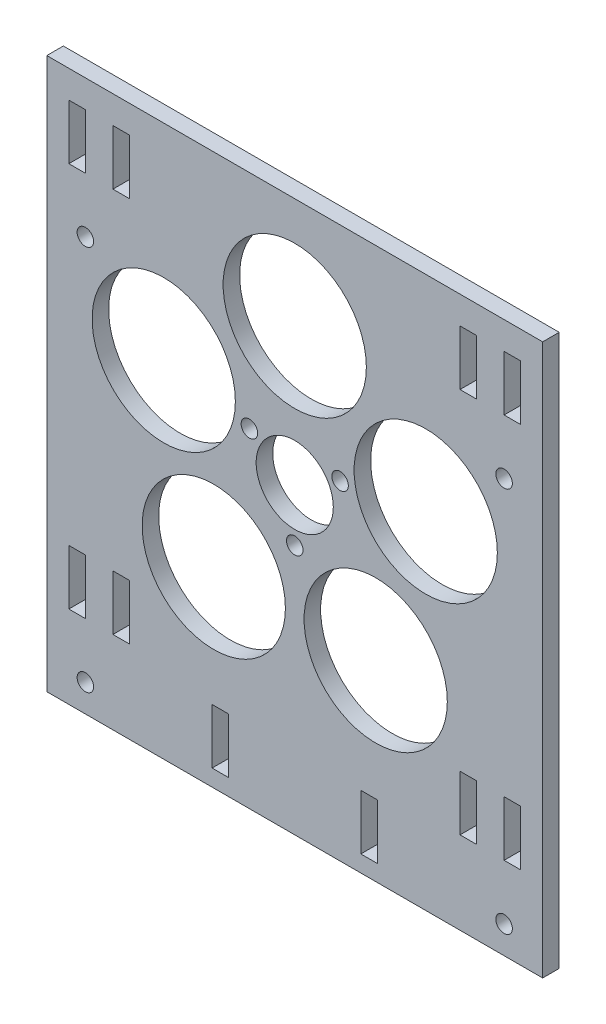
SolidWorks part; units mm, degrees
ref_plane "前视基准面" through (0, 0, 0) normal (0, 0, 1) x (1, 0, 0)
ref_plane "上视基准面" through (0, 0, 0) normal (0, 1, 0) x (1, 0, 0)
ref_plane "右视基准面" through (0, 0, 0) normal (1, 0, 0) x (0, 0, -1)
sketch "草图1" plane through (0, 0, 0) normal (0, 0, 1) x (1, 0, 0)
  line L0 (0, 0) -> (-23.7764, 7.7254) construction
  circle A0 centre (0, 0) radius 12.5
  circle A1 centre (0, 25) radius 12.5
  circle A2 centre (23.7764, 7.7254) radius 12.5
  circle A3 centre (14.6946, -20.2254) radius 12.5
  circle A4 centre (-14.6946, -20.2254) radius 12.5
  circle A5 centre (-23.7764, 7.7254) radius 12.5
  circle A6 centre (-23.7764, 7.7254) radius 10.5
  circle A7 centre (0, 25) radius 10.5
  circle A8 centre (23.7764, 7.7254) radius 10.5
  circle A9 centre (-14.6946, -20.2254) radius 10.5
  circle A10 centre (14.6946, -20.2254) radius 10.5
  circle A11 centre (-23.7764, 7.7254) radius 9
  circle A12 centre (0, 25) radius 9
  circle A13 centre (23.7764, 7.7254) radius 9
  circle A14 centre (14.6946, -20.2254) radius 9
  circle A15 centre (-14.6946, -20.2254) radius 9
  circle A17 centre (0, 0) radius 35.5
  point P16 (0, 0)
  dimension "D1" = 25
  dimension "D2" = 25
  dimension "D4" = 21
  dimension "D5" = 21
  dimension "D6" = 21
  dimension "D7" = 21
  dimension "D8" = 18
  dimension "D11" = 21
  dimension "D3" = 5
  dimension "D10" = 25
  dimension "D9" = 5
sketch "草图2" plane through (0, 0, 0) normal (0, 0, 1) x (1, 0, 0)
  line L0 (-10.5, 25) -> (-10.5, 27.9643)
  line L1 (10.5, 25) -> (10.5, 27.9643)
  line L2 (20.5317, 17.7115) -> (23.3509, 18.6275)
  line L3 (27.0211, -2.2607) -> (29.8403, -1.3447)
  line L4 (23.1893, -14.0537) -> (24.9317, -16.4518)
  line L5 (6.2, -26.3972) -> (7.9423, -28.7953)
  line L6 (-6.2, -26.3972) -> (-7.9423, -28.7953)
  line L7 (-23.1893, -14.0537) -> (-24.9317, -16.4518)
  line L8 (-27.0211, -2.2607) -> (-29.8403, -1.3447)
  line L9 (-20.5317, 17.7115) -> (-23.3509, 18.6275)
  line L11 (0, 0) -> (27.0211, -2.2607) construction
  circle A0 centre (14.6946, -20.2254) radius 10.5 construction
  circle A1 centre (-14.6946, -20.2254) radius 10.5 construction
  circle A2 centre (23.7764, 7.7254) radius 10.5 construction
  circle A3 centre (0, 25) radius 10.5 construction
  circle A4 centre (-23.7764, 7.7254) radius 10.5 construction
  circle A5 centre (0, 0) radius 35.5 construction
  arc A6 (23.1893, -14.0537) -> (6.2, -26.3972) centre (14.6946, -20.2254) ccw
  arc A7 (-6.2, -26.3972) -> (-23.1893, -14.0537) centre (-14.6946, -20.2254) ccw
  arc A8 (20.5317, 17.7115) -> (27.0211, -2.2607) centre (23.7764, 7.7254) ccw
  arc A9 (-10.5, 25) -> (10.5, 25) centre (0, 25) ccw
  arc A10 (-27.0211, -2.2607) -> (-20.5317, 17.7115) centre (-23.7764, 7.7254) ccw
  arc A11 (-16.3413, 31.5153) -> (-24.9231, 25.2802) centre (0, 0) ccw
  arc A12 (-35.0225, -5.8027) -> (-31.7446, -15.8912) centre (0, 0) ccw
  arc A13 (24.9231, 25.2802) -> (16.3413, 31.5153) centre (0, 0) ccw
  arc A14 (31.7446, -15.8912) -> (35.0225, -5.8027) centre (0, 0) ccw
  arc A15 (-5.3039, -35.1016) -> (5.3039, -35.1016) centre (0, 0) ccw
  arc A16 (23.3509, 18.6275) -> (24.9231, 25.2802) centre (22.1148, 22.4318) ccw
  arc A17 (10.5, 27.9643) -> (16.3413, 31.5153) centre (14.5, 27.9643) cw
  arc A18 (-10.5, 27.9643) -> (-16.3413, 31.5153) centre (-14.5, 27.9643) ccw
  arc A19 (-23.3509, 18.6275) -> (-24.9231, 25.2802) centre (-22.1148, 22.4318) cw
  arc A20 (24.9317, -16.4518) -> (31.7446, -15.8912) centre (28.1677, -14.1007) ccw
  arc A21 (7.9423, -28.7953) -> (5.3039, -35.1016) centre (4.7062, -31.1465) cw
  arc A22 (-7.9423, -28.7953) -> (-5.3039, -35.1016) centre (-4.7062, -31.1465) ccw
  arc A23 (-24.9317, -16.4518) -> (-31.7446, -15.8912) centre (-28.1677, -14.1007) cw
  arc A24 (-35.0225, -5.8027) -> (-29.8403, -1.3447) centre (-31.0763, -5.1489) cw
  arc A25 (29.8403, -1.3447) -> (35.0225, -5.8027) centre (31.0763, -5.1489) cw
  dimension "D2" = 4
  dimension "D3" = 4
  dimension "D1" = 5
sketch "草图3" plane through (0, 0, 0) normal (0, 0, 1) x (1, 0, 0)
  line L0 (-45, 45) -> (45, 45)
  line L1 (45, 45) -> (45, -45)
  line L3 (-45, -45) -> (-45, 45)
  line L4 (-45, -45) -> (-45, -55)
  line L7 (-45, -55) -> (45, -55)
  line L8 (45, -45) -> (45, -55)
  dimension "D1" = 90
  dimension "D2" = 90
  dimension "D3" = 10
extrude "凸台-拉伸2" add sketch "草图3" along normal blind 3
sketch "草图4" plane through (0, 0, 3) normal (0, 0, 1) x (1, 0, 0)
  circle A0 centre (0, 0) radius 13.5
sketch "草图5" plane through (0, 0, 3) normal (0, 0, 1) x (1, 0, 0)
  line L0 (-33, 40) -> (-33, 30)
  line L1 (-33, 30) -> (-30, 30)
  line L2 (-30, 30) -> (-30, 40)
  line L3 (-30, 40) -> (-33, 40)
  line L4 (30, 40) -> (30, 30)
  line L5 (30, 30) -> (33, 30)
  line L6 (33, 30) -> (33, 40)
  line L7 (33, 40) -> (30, 40)
  line L8 (-33, -30) -> (-33, -40)
  line L9 (-33, -40) -> (-30, -40)
  line L10 (-30, -40) -> (-30, -30)
  line L11 (-30, -30) -> (-33, -30)
  line L12 (30, -30) -> (30, -40)
  line L13 (30, -40) -> (33, -40)
  line L14 (33, -40) -> (33, -30)
  line L15 (33, -30) -> (30, -30)
  line L16 (0, 45) -> (0, -54.353) construction
  line L17 (-45, 45) -> (45, 45) construction
  line L18 (-45, 0) -> (45, 0) construction
  line L19 (-45, -55) -> (-45, 45) construction
  line L20 (45, -55) -> (45, 45) construction
  dimension "D1" = 3
  dimension "D2" = 10
  dimension "D3" = 10
  dimension "D4" = 3
  dimension "D5" = 10
  dimension "D6" = 3
  dimension "D7" = 3
  dimension "D8" = 10
  dimension "D9" = 30
  dimension "D10" = 30
  dimension "D11" = 30
  dimension "D12" = 30
  dimension "D13" = 30
  dimension "D14" = 30
  dimension "D15" = 30
  dimension "D16" = 30
extrude "切除-拉伸1" cut sketch "草图5" against normal blind 10
sketch "草图6" plane through (0, 0, 3) normal (0, 0, 1) x (1, 0, 0)
  circle A15 centre (0, 25) radius 13
  circle A16 centre (23.7764, 7.7254) radius 13
  circle A17 centre (14.6946, -20.2254) radius 13
  circle A18 centre (-14.6946, -20.2254) radius 13
  circle A19 centre (-23.7764, 7.7254) radius 13
  dimension "D1" = 26
  dimension "D2" = 26
  dimension "D3" = 26
  dimension "D4" = 26
  dimension "D5" = 26
extrude "切除-拉伸2" cut sketch "草图6" against normal blind 10
sketch "草图7" plane through (0, 0, 3) normal (0, 0, 1) x (1, 0, 0)
  circle A0 centre (0, 0) radius 7
  circle A1 centre (0, -9.5) radius 1.5
  circle A2 centre (-8.2272, 4.75) radius 1.5
  circle A3 centre (8.2272, 4.75) radius 1.5
  point P11 (0, 0)
  dimension "D1" = 14
  dimension "D2" = 3
  dimension "D3" = 9.5
  dimension "D4" = 3
extrude "切除-拉伸3" cut sketch "草图7" against normal blind 10
sketch "草图8" plane through (0, 0, 3) normal (0, 0, 1) x (1, 0, 0)
  line L0 (-38, -30) -> (-38, -40)
  line L1 (-38, -40) -> (-41, -40)
  line L2 (-41, -40) -> (-41, -30)
  line L3 (-41, -30) -> (-38, -30)
  line L4 (-41, 40) -> (-41, 30)
  line L5 (-41, 30) -> (-38, 30)
  line L6 (-38, 30) -> (-38, 40)
  line L7 (-38, 40) -> (-41, 40)
  line L8 (0, 45) -> (0, -55) construction
  line L9 (-45, 45) -> (45, 45) construction
  line L10 (-45, -55) -> (45, -55) construction
  line L11 (-33, -30) -> (-33, -40) construction
  line L13 (-30, 40) -> (-33, 40) construction
  line L14 (-15, -42) -> (-12, -42)
  line L15 (-12, -42) -> (-12, -52)
  line L16 (-12, -52) -> (-15, -52)
  line L17 (-15, -52) -> (-15, -42)
  line L18 (15, -52) -> (15, -42)
  line L19 (12, -52) -> (15, -52)
  line L20 (12, -42) -> (12, -52)
  line L21 (15, -42) -> (12, -42)
  line L22 (38, 40) -> (41, 40)
  line L23 (38, 30) -> (38, 40)
  line L24 (41, 30) -> (38, 30)
  line L25 (41, 40) -> (41, 30)
  line L26 (41, -30) -> (38, -30)
  line L27 (41, -40) -> (41, -30)
  line L28 (38, -40) -> (41, -40)
  line L29 (38, -30) -> (38, -40)
  circle A0 centre (-38, -50) radius 1.5
  circle A1 centre (-38, 20) radius 1.5
  circle A2 centre (38, 20) radius 1.5
  circle A3 centre (38, -50) radius 1.5
  dimension "D11" = 3
  dimension "D12" = 5
  dimension "D13" = 25
  dimension "D1" = 3
  dimension "D2" = 10
  dimension "D3" = 5
  dimension "D4" = 15
  dimension "D5" = 3
  dimension "D6" = 10
  dimension "D7" = 10
  dimension "D8" = 3
  dimension "D9" = 3
  dimension "D10" = 12
extrude "切除-拉伸4" cut sketch "草图8" against normal blind 10
